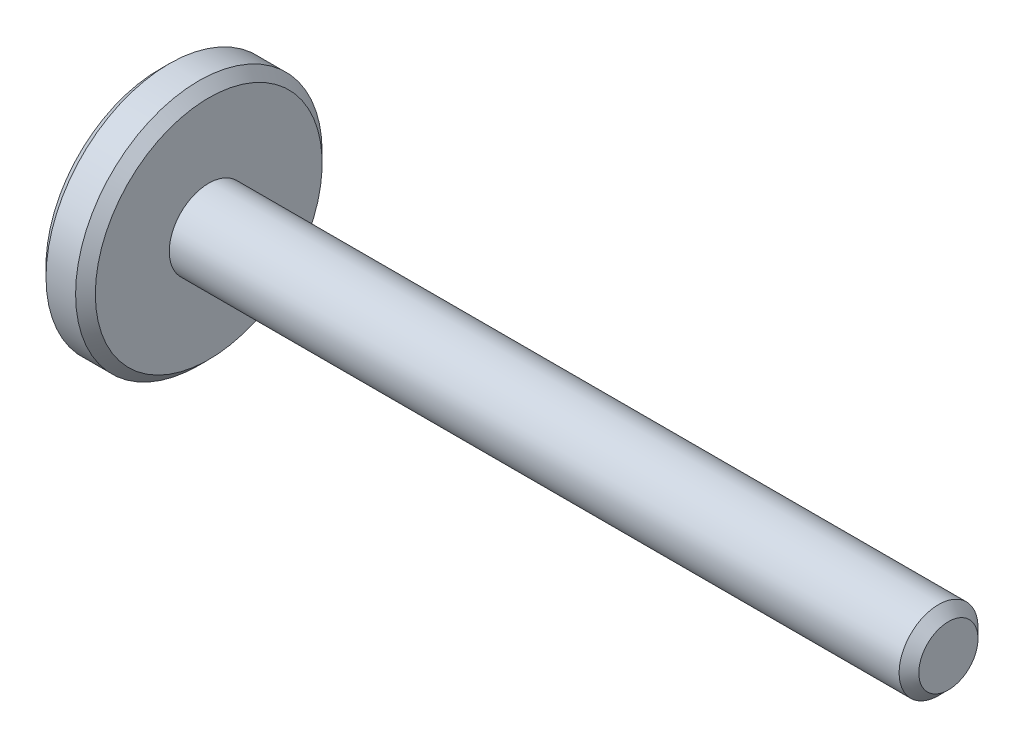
SolidWorks part; units mm, degrees
ref_plane "Plan de face" through (0, 0, 0) normal (0, 0, 1) x (1, 0, 0)
ref_plane "Plan de dessus" through (0, 0, 0) normal (0, 1, 0) x (1, 0, 0)
ref_plane "Plan de droite" through (0, 0, 0) normal (1, 0, 0) x (0, 0, -1)
sketch "Esquisse1" plane through (0, 0, 0) normal (0, 0, 1) x (1, 0, 0)
  line L0 (0, 0) -> (0, 12.5)
  line L1 (0, 12.5) -> (5, 12.5)
  line L2 (80, 4) -> (80, 0)
  line L3 (-12.3201, 0) -> (91.5611, 0) construction
  line L4 (5, 12.5) -> (5, 4)
  line L5 (5, 4) -> (80, 4)
  line L8 (80, 0) -> (0, 0)
  dimension "D1" = 12.5
  dimension "D2" = 5
  dimension "D3" = 4
  dimension "D4" = 80
revolve "Révolution1" add sketch "Esquisse1" angle 360 about L3
chamfer "Chanfrein1" distance 1 angle 45 3 edges at (80, 0, 4) (0, 0, 12.5) (5, 0, 12.5)
